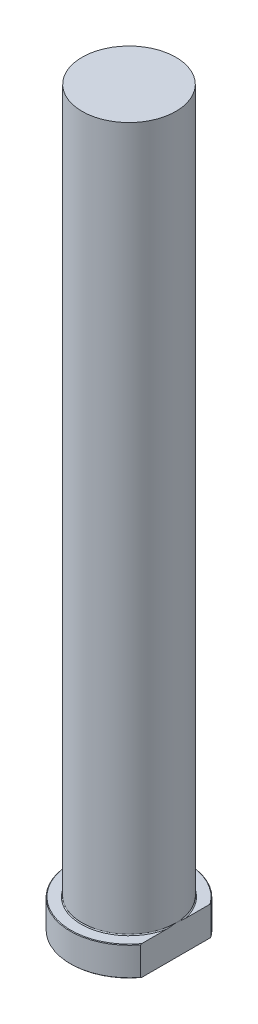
SolidWorks part; units mm, degrees
ref_plane "Front Plane" through (0, 0, 0) normal (0, 0, 1) x (1, 0, 0)
ref_plane "Top Plane" through (0, 0, 0) normal (0, 1, 0) x (1, 0, 0)
ref_plane "Right Plane" through (0, 0, 0) normal (1, 0, 0) x (0, 0, -1)
sketch "Sketch1" plane through (0, 0, 0) normal (0, 0, 1) x (1, 0, 0)
  line L0 (0, 259.9588) -> (0, -15.1925) construction
  line L1 (0, 0) -> (-20, 0)
  line L2 (-20, 0) -> (-20, 10)
  line L3 (-20, 10) -> (-16, 10)
  line L4 (-16, 10) -> (-16, 250)
  line L5 (-16, 250) -> (0, 250)
  line L6 (0, 250) -> (0, 0)
  dimension "L" = 250
  dimension "H" = 40
  dimension "T" = 10
  dimension "D" = 32
revolve "Revolve1" add sketch "Sketch1" angle 360 about L0
chamfer "Chamfer1" distance 0.2 angle 45 2 edges at (0, 10, 20) (0, 0, 20)
fillet "Fillet1" radius 0.3 1 edges at (0, 10, 16)
sketch "Sketch2" plane through (0, 0, 0) normal (0, 1, 0) x (1, 0, 0)
  line L0 (16, 12) -> (16, -12)
  circle A0 centre (0, 0) radius 20 construction
  arc A1 (16, -12) -> (16, 12) centre (0, 0) ccw
  circle A2 centre (0, 0) radius 16 construction
extrude "KEY" cut sketch "Sketch2" along normal through all
